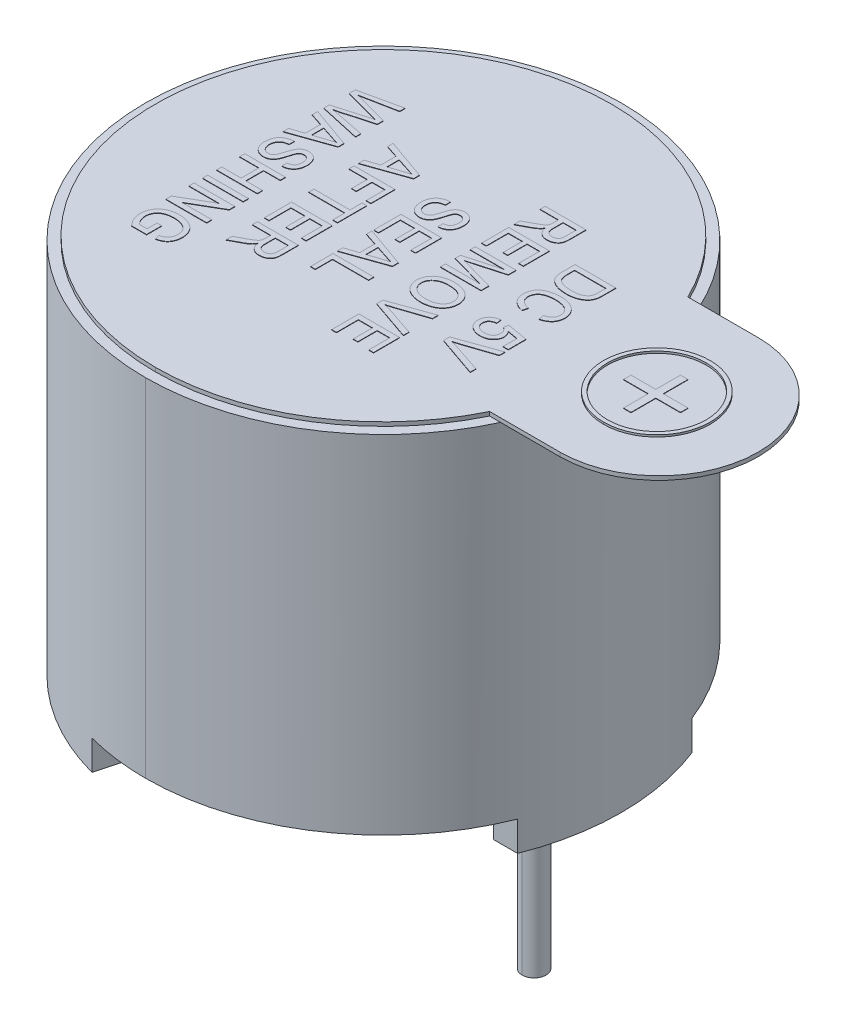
SolidWorks part; units mm, degrees
ref_plane "Plano frontal" through (0, 0, 0) normal (0, 0, 1) x (1, 0, 0)
ref_plane "Plano superior" through (0, 0, 0) normal (0, 1, 0) x (1, 0, 0)
ref_plane "Plano direito" through (0, 0, 0) normal (1, 0, 0) x (0, 0, -1)
imported_body "ALSRobot-BUZZER.STEP"
sketch "Esboço5" plane through (0, 9.6, 0) normal (0, 1, 0) x (1, 0, 0)
  line L0 (3.0568, 4.8702) -> (3.0568, -4.8702) construction
  arc A0 (5.1781, 2.5) -> (0, 5.75) centre (0, 0) ccw construction
  arc A1 (0, -5.75) -> (5.1781, -2.5) centre (0, 0) ccw construction
  text T0 "DC 5V  REMOVE  SEAL  AFTER  WASHING" font "Arial" height in points 4
extrude "Ressalto-extrusão2" add sketch "Esboço5" along normal blind 0.01
